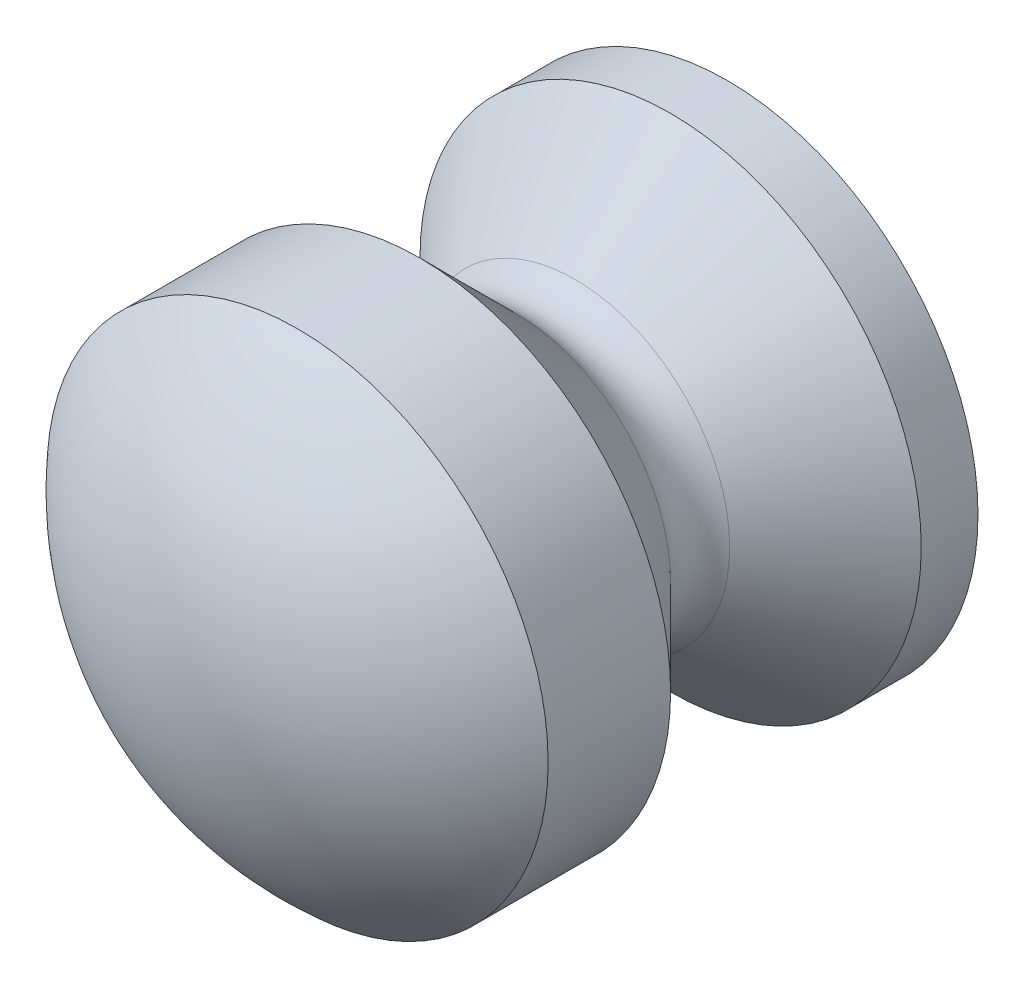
SolidWorks part; units mm, degrees
ref_plane "Спереди" through (0, 0, 0) normal (0, 0, 1) x (1, 0, 0)
ref_plane "Сверху" through (0, 0, 0) normal (0, 1, 0) x (1, 0, 0)
ref_plane "Справа" through (0, 0, 0) normal (1, 0, 0) x (0, 0, -1)
sketch "Эскиз1" plane through (0, 0, 0) normal (1, 0, 0) x (0, 0, -1)
  line L0 (0, 0) -> (18.1208, 0) construction
  line L1 (2.1499, 4.7625) -> (4.4767, 4.7625)
  line L2 (4.4767, 4.7625) -> (6.2967, 2.9425)
  line L3 (7.4193, 2.9425) -> (9.2392, 4.7625)
  line L4 (9.2392, 4.7625) -> (10.3187, 4.7625)
  line L5 (10.3187, 4.7625) -> (10.3187, 0)
  line L6 (10.3187, 0) -> (0, 0)
  arc A0 (0, 0) -> (2.1499, 4.7625) centre (6.35, 0) cw
  arc A1 (6.2967, 2.9425) -> (7.4193, 2.9425) centre (6.858, 3.5038) ccw
  point P12 (6.858, 2.3813)
  dimension "D3" = 6.35
  dimension "D7" = 0.7937
  dimension "D1" = 9.525
  dimension "D2" = 6.858
  dimension "D4" = 10.3187
  dimension "D5" = 45
  dimension "D6" = 4.7625
revolve "Повернуть1" add sketch "Эскиз1" angle 360 about L0
